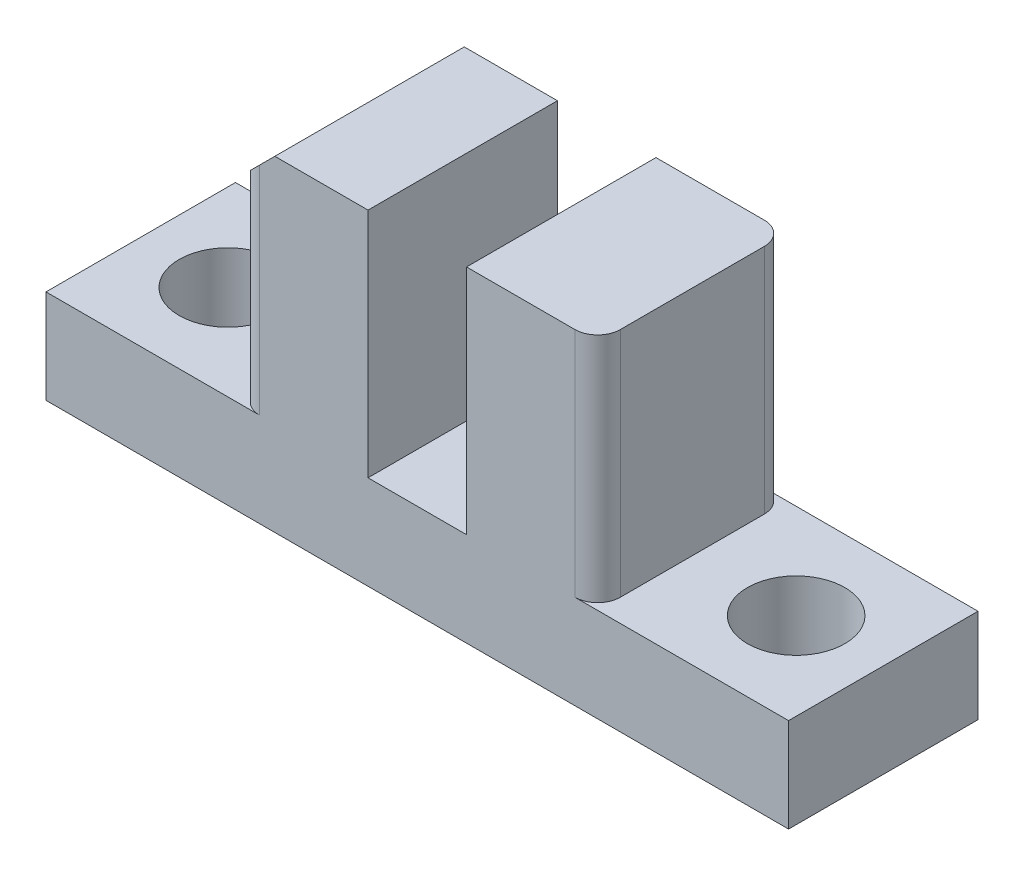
SolidWorks part; units mm, degrees
ref_plane "Front" through (0, 0, 0) normal (0, 0, 1) x (1, 0, 0)
ref_plane "Top" through (0, 0, 0) normal (0, 1, 0) x (1, 0, 0)
ref_plane "Right" through (0, 0, 0) normal (1, 0, 0) x (0, 0, -1)
sketch "Sketch1" plane through (0, 0, 0) normal (0, 0, 1) x (1, 0, 0)
  line L0 (1.651, 10.922) -> (1.651, 3.1496)
  line L1 (-6.0452, 10.922) -> (-1.651, 10.922)
  line L2 (-6.0452, 10.922) -> (-6.0452, 3.1496)
  line L4 (6.0452, 10.922) -> (6.0452, 3.1496)
  line L5 (1.651, 3.1496) -> (-1.651, 3.1496)
  line L6 (-1.651, 3.1496) -> (-1.651, 10.922)
  line L7 (1.651, 10.922) -> (6.0452, 10.922)
  line L8 (-12.446, 3.1496) -> (-6.0452, 3.1496)
  line L9 (6.0452, 3.1496) -> (12.446, 3.1496)
  line L10 (12.446, 0) -> (12.446, 3.1496)
  line L11 (-12.446, 0) -> (-12.446, 3.1496)
  line L13 (-12.446, 0) -> (12.446, 0)
  point P9 (0, 3.1496)
  point P18 (0, 0)
  dimension "D1" = 24.892
  dimension "D2" = 3.1496
  dimension "D4" = 12.0904
  dimension "D5" = 3.302
  dimension "D6" = 10.922
extrude "Extrude1" add sketch "Sketch1" along normal blind 6.35
chamfer "Chamfer1" distance 1.27 angle 45 1 edges at (-6.0452, 10.922, 3.175)
hole_wizard "#30 (0.128500) Diameter Hole1" positions "Sketch3" profile "Sketch2" hole size "#30" standard "Ansi Inch"
sketch "Sketch3" plane through (0, 3.1496, 0) normal (0, 1, 0) x (-1, 0, 0)
  line L0 (-12.446, 0) -> (-6.0452, 0) construction
  point P0 (9.525, 3.175)
  point P1 (-9.525, 3.175)
  dimension "D1" = 3.175
  dimension "D2" = 19.05
  dimension "D3" = 9.525
sketch "Sketch2" plane through (-9.525, 3.1496, 3.175) normal (1, 0, 0) x (0, 0, 1)
  line L0 (0, 0) -> (0, 3.1496)
  line L1 (0, 3.1496) -> (1.6319, 3.1496)
  line L2 (1.6319, 3.1496) -> (1.6319, 0)
  line L5 (1.6319, 0) -> (0, 0)
  line L11 (0, -6.35) -> (0, 107.95) construction
  dimension "Thru Hole Dia." = 3.2639
  dimension "Thru Hole Depth" = 3.1496
fillet "Fillet1" radius 0.762 4 edges at (6.0452, 7.0358, 0) (6.0452, 7.0358, 6.35) (-6.0452, 6.4008, 0) (-6.0452, 6.4008, 6.35)
ref_plane "center" through (0, 0, 3.175) normal (0, 0, 1) x (1, 0, 0)
